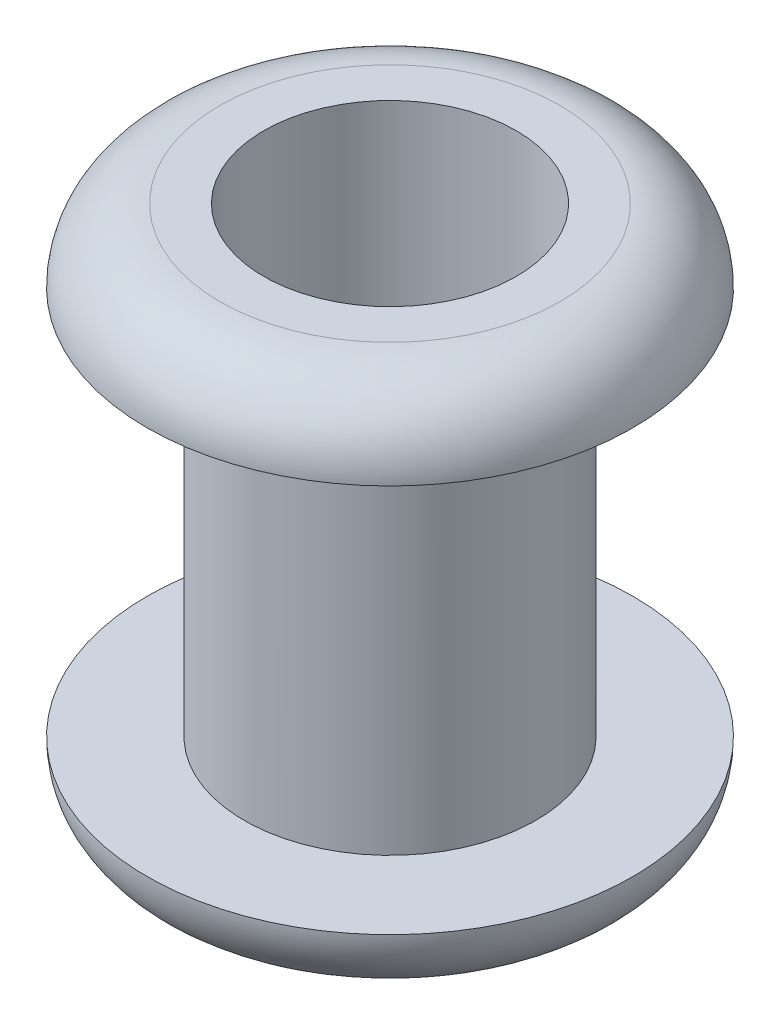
SolidWorks part; units mm, degrees
ref_plane "Front" through (0, 0, 0) normal (0, 0, 1) x (1, 0, 0)
ref_plane "Top" through (0, 0, 0) normal (0, 1, 0) x (1, 0, 0)
ref_plane "Right" through (0, 0, 0) normal (1, 0, 0) x (0, 0, -1)
sketch "Sketch1" plane through (0, 0, 0) normal (0, 1, 0) x (1, 0, 0)
  circle A0 centre (0, 0) radius 1.5
  circle A1 centre (0, 0) radius 1.2
  dimension "D1" = 3
  dimension "D2" = 0.3
extrude "Extrude1" add sketch "Sketch1" along normal blind 4
sketch "Sketch2" plane through (0, 4, 0) normal (0, 1, 0) x (-1, 0, 0)
  circle A0 centre (0, 0) radius 2.5
extrude "Extrude2" add sketch "Sketch2" along normal blind 0.75
sketch "Sketch3" plane through (0, 0, 0) normal (0, -1, 0) x (1, 0, 0)
  circle A0 centre (0, 0) radius 2.5
extrude "Extrude3" add sketch "Sketch3" along normal blind 0.75
sketch "Sketch4" plane through (0, -0.75, 0) normal (0, -1, 0) x (1, 0, 0)
  circle A0 centre (0, 0) radius 1.3
extrude "Cut-Extrude1" cut sketch "Sketch4" against normal through all
fillet "Fillet1" radius 0.75 2 edges at (0, -0.75, -2.5) (0, 4.75, 2.5)
